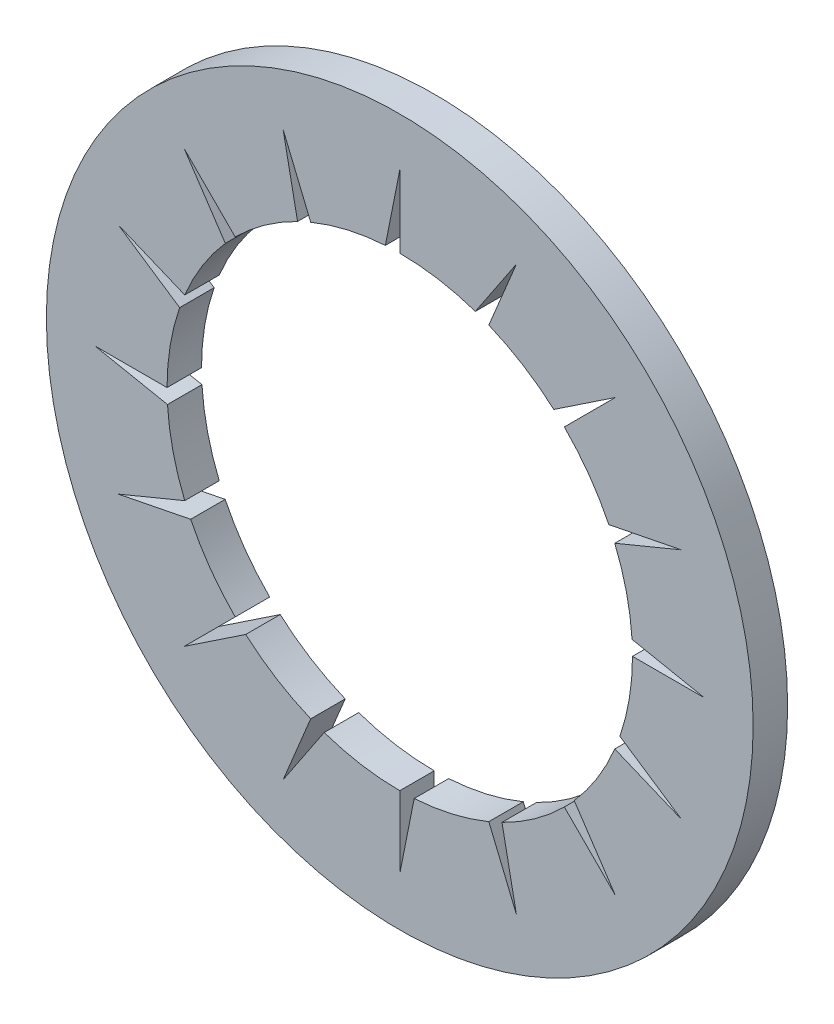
SolidWorks part; units mm, degrees
ref_plane "Front Plane" through (0, 0, 0) normal (0, 0, 1) x (1, 0, 0)
ref_plane "Top Plane" through (0, 0, 0) normal (0, 1, 0) x (1, 0, 0)
ref_plane "Right Plane" through (0, 0, 0) normal (1, 0, 0) x (0, 0, -1)
sketch "BodySke" plane through (0, 0, 0) normal (0, 1, 0) x (1, 0, 0)
  line L0 (0, 0) -> (0, 16) construction
  line L2 (6.75, 0) -> (10.25, 0)
  line L3 (6.75, 0) -> (6.75, 1)
  line L4 (6.75, 1) -> (10.25, 1)
  line L5 (10.25, 0) -> (10.25, 1)
  dimension "Inner_dia" = 13.5
  dimension "Outer_dia" = 20.5
  dimension "Thickness" = 1
  dimension "Num_tooth" = 16
revolve "BaseBody" add sketch "BodySke" angle 360 about L0
sketch "ToothSke" plane through (0, 0, 0) normal (0, 0, 1) x (1, 0, 0)
  line L0 (0, 0) -> (0, 2.7341) construction
  line L1 (0, 8.84) -> (-0.4183, 6.737)
  line L3 (0, 6.75) -> (0, 8.84)
  circle A0 centre (0, 0) radius 8.84 construction
  arc A1 (-0.7581, 8.8074) -> (0.7581, 8.8074) centre (0, 0) cw construction
  circle A2 centre (0, 0) radius 6.75 construction
  arc A3 (0, 6.75) -> (-0.4183, 6.737) centre (0, 0) ccw
  dimension "D1" = 17.68
  dimension "D2" = 11.25
extrude "ToothCut" cut sketch "ToothSke" against normal through all
pattern_circular "ToothPat" count 16 over 360 about axis through (0, 0, 0) along (0, 0, 1) of "ToothCut"
equation "\"D1@ToothSke\" =  ( \"Inner_dia@BodySke\" + \"Outer_dia@BodySke\" )  * 0.52"
equation "\"Num_tooth@ToothPat\" = \"Num_tooth@BodySke\""
equation "\"D2@ToothSke\" = 180 / \"Num_tooth@BodySke\""
